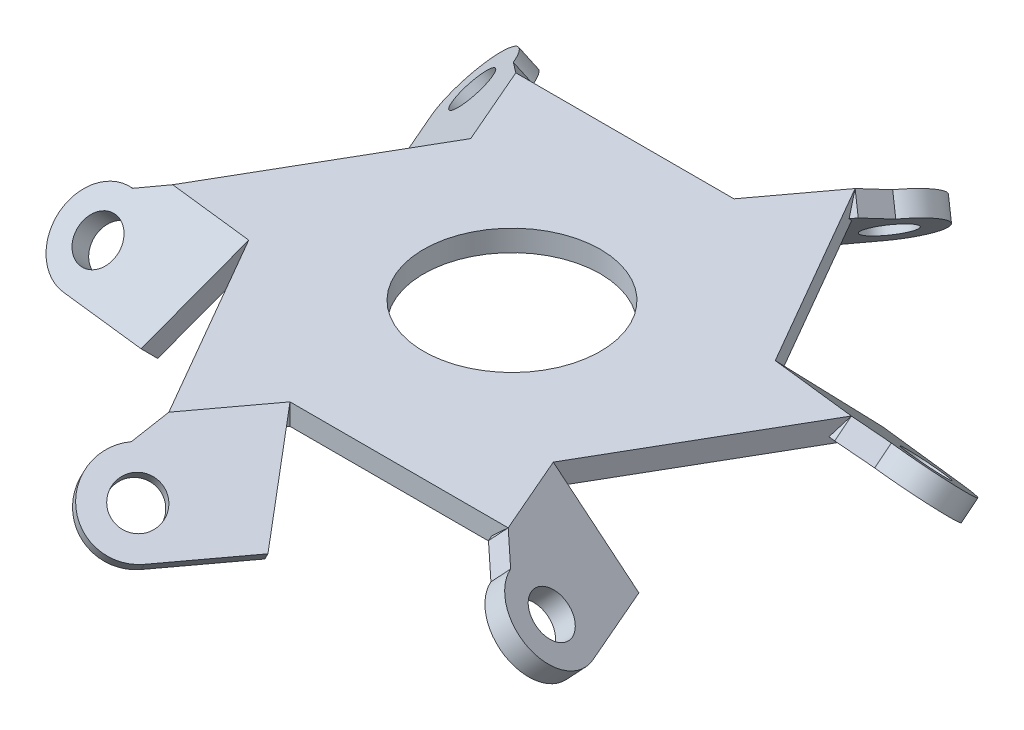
SolidWorks part; units mm, degrees
other "<MecanumHub - (Top)>-<Imported1>"
ref_plane "Front Plane" through (0, 0, 0) normal (0, 0, 1) x (1, 0, 0)
ref_plane "Top Plane" through (0, 0, 0) normal (0, 1, 0) x (1, 0, 0)
ref_plane "Right Plane" through (0, 0, 0) normal (1, 0, 0) x (0, 0, -1)
mirrored part "MecanumHub - (Top)_Mirrored"
